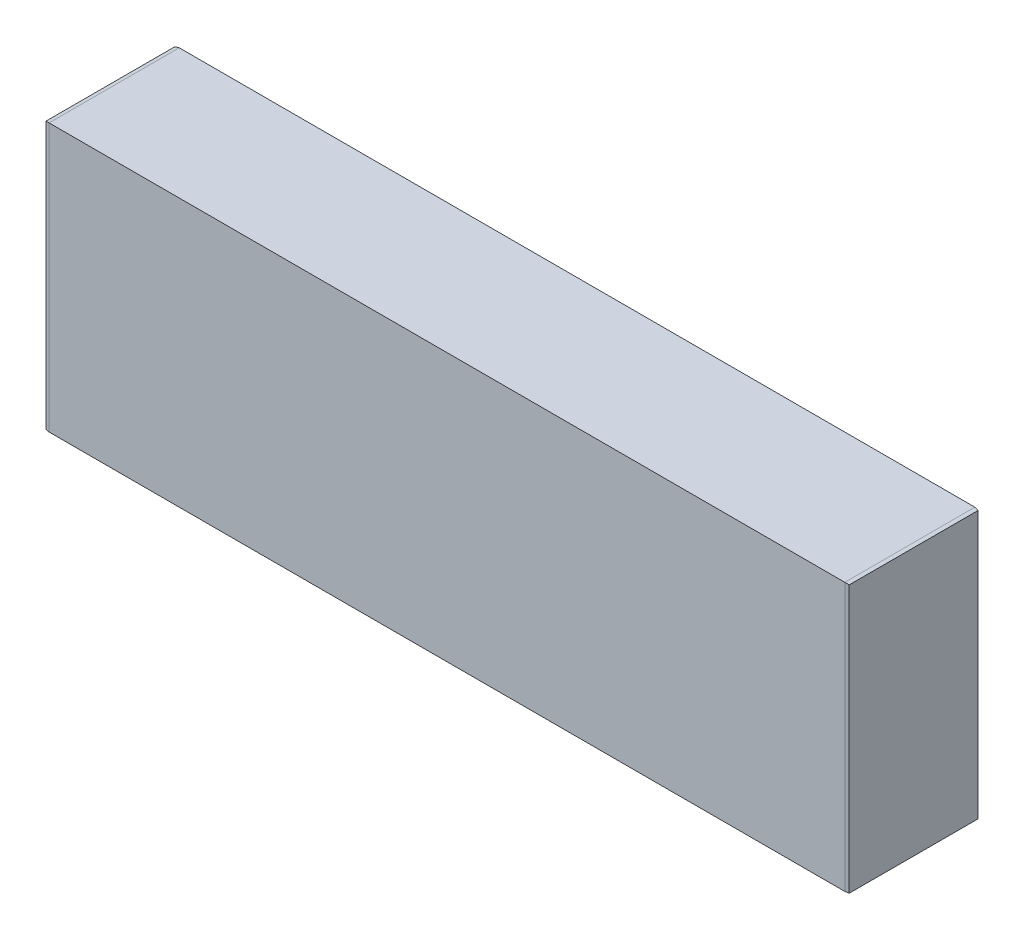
SolidWorks part; units mm, degrees
ref_plane "Front Plane" through (0, 0, 0) normal (0, 0, 1) x (1, 0, 0)
ref_plane "Top Plane" through (0, 0, 0) normal (0, 1, 0) x (1, 0, 0)
ref_plane "Right Plane" through (0, 0, 0) normal (1, 0, 0) x (0, 0, -1)
sketch "Sketch1" plane through (0, 0, 0) normal (0, 0, 1) x (1, 0, 0)
  line L1 (-45.3301, 26.9451) -> (167.6699, 26.9451)
  line L2 (-45.3301, 26.9451) -> (-45.3301, -44.0549)
  line L3 (-45.3301, -44.0549) -> (167.6699, -44.0549)
  line L4 (167.6699, 26.9451) -> (167.6699, -44.0549)
  dimension "D1" = 213
  dimension "D2" = 71
extrude "Boss-Extrude1" add sketch "Sketch1" along normal blind 34.5
chamfer "Chamfer1" distance 1 angle 10 3 edges at (-45.3301, -8.5549, 34.5) (-45.3301, -8.5549, 0) (-45.3301, 26.9451, 17.25)
chamfer "Chamfer2" distance 1 angle 10 3 edges at (167.6699, -8.5549, 0) (167.6699, -8.5549, 34.5) (167.6699, 26.9451, 17.25)
sketch "Sketch3" plane through (-45.3301, 0, 0) normal (-1, 0, 0) x (0, 0, 1)
  line L0 (18.2561, -14.9433) -> (18.2561, -35.97) construction
  line L1 (5.1763, -17.6597) -> (29.3237, -17.6597)
  line L2 (5.1763, -17.6597) -> (5.1763, -33.8573)
  line L3 (5.1763, -33.8573) -> (29.3237, -33.8573)
  line L4 (29.3237, -17.6597) -> (29.3237, -33.8573)
  line L5 (6.8058, -19.1688) -> (10.8058, -19.1688)
  line L6 (6.8058, -19.1688) -> (6.8058, -32.5494)
  line L7 (6.8058, -32.5494) -> (10.8058, -32.5494)
  line L8 (10.8058, -19.1688) -> (10.8058, -32.5494)
  line L9 (12.4353, -19.1688) -> (16.4353, -19.1688)
  line L10 (12.4353, -19.1688) -> (12.4353, -32.5494)
  line L11 (12.4353, -32.5494) -> (16.4353, -32.5494)
  line L12 (16.4353, -19.1688) -> (16.4353, -32.5494)
  line L13 (18.0647, -19.1688) -> (22.0647, -19.1688)
  line L14 (18.0647, -19.1688) -> (18.0647, -32.5494)
  line L15 (18.0647, -32.5494) -> (22.0647, -32.5494)
  line L16 (22.0647, -19.1688) -> (22.0647, -32.5494)
  line L17 (23.6942, -19.1688) -> (27.6942, -19.1688)
  line L18 (23.6942, -19.1688) -> (23.6942, -32.5494)
  line L19 (23.6942, -32.5494) -> (27.6942, -32.5494)
  line L20 (27.6942, -19.1688) -> (27.6942, -32.5494)
  line L21 (5.1763, -19.1688) -> (6.8058, -19.1688) construction
  line L22 (10.8058, -19.1688) -> (12.4353, -19.1688) construction
  line L23 (16.4353, -19.1688) -> (18.0647, -19.1688) construction
  line L24 (22.0647, -19.1688) -> (23.6942, -19.1688) construction
  line L25 (27.6942, -19.1688) -> (29.3237, -19.1688) construction
  line L26 (34.3237, -44.0549) -> (34.3237, 26.7688) construction
  line L27 (0.1763, 26.7688) -> (0.1763, -44.0549) construction
  line L28 (34.3237, -44.0549) -> (0.1763, -44.0549) construction
  line L29 (10.8058, -32.5494) -> (10.8058, -33.8573) construction
  line L30 (16.4353, -32.5494) -> (16.4353, -33.8573) construction
  line L31 (22.0647, -32.5494) -> (22.0647, -33.8573) construction
  line L32 (27.6942, -32.5494) -> (27.6942, -33.8573) construction
  dimension "D1" = 4
  dimension "D2" = 4
  dimension "D3" = 4
  dimension "D4" = 4
  dimension "D5" = 5
  dimension "D6" = 5
  dimension "D7" = 10.1976
extrude "Cut-Extrude2" cut sketch "Sketch3" against normal blind 1
sketch "Sketch4" plane through (-45.3301, 0, 0) normal (-1, 0, 0) x (0, 0, 1)
  line L0 (8.6763, -39.3573) -> (8.6763, -41.974) construction
  line L1 (8.1763, -35.8573) -> (9.1763, -35.8573)
  line L2 (8.1763, -35.8573) -> (8.1763, -38.3573)
  line L3 (8.1763, -41.8573) -> (9.1763, -41.8573)
  line L4 (9.1763, -35.8573) -> (9.1763, -38.3573)
  line L5 (5.6763, -38.3573) -> (8.1763, -38.3573)
  line L6 (5.6763, -38.3573) -> (5.6763, -39.3573)
  line L7 (5.6763, -39.3573) -> (8.1763, -39.3573)
  line L8 (11.6763, -38.3573) -> (11.6763, -39.3573)
  line L9 (8.954, -38.8573) -> (13.6707, -38.8573) construction
  line L10 (5.1763, -33.8573) -> (29.3237, -33.8573) construction
  line L11 (0.1763, 26.7688) -> (0.1763, -44.0549) construction
  line L12 (13.6707, -38.8573) -> (32.3354, -38.8573) construction
  line L13 (22.7204, -38.3573) -> (28.7204, -38.3573)
  line L14 (22.7204, -38.3573) -> (22.7204, -39.3573)
  line L15 (22.7204, -39.3573) -> (28.7204, -39.3573)
  line L16 (28.7204, -38.3573) -> (28.7204, -39.3573)
  line L17 (9.1763, -38.3573) -> (11.6763, -38.3573)
  line L18 (8.1763, -39.3573) -> (8.1763, -41.8573)
  line L19 (9.1763, -39.3573) -> (11.6763, -39.3573)
  line L20 (9.1763, -39.3573) -> (9.1763, -41.8573)
  dimension "D1" = 1
  dimension "D2" = 1
  dimension "D3" = 6
  dimension "D5" = 6
  dimension "D6" = 3
  dimension "D7" = 2
  dimension "D8" = 5.5
  dimension "D9" = 6
  dimension "D10" = 1
  dimension "D11" = 0.5
extrude "Cut-Extrude3" cut sketch "Sketch4" against normal blind 1
